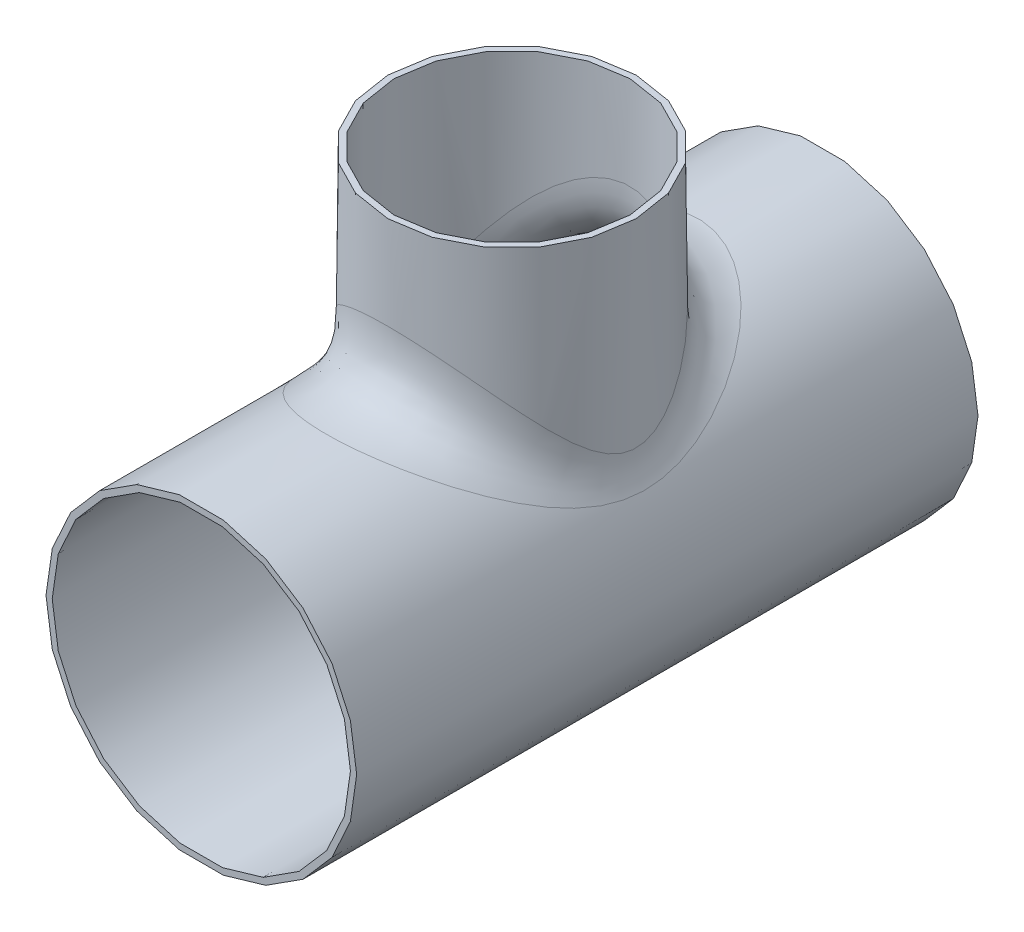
SolidWorks part; units mm, degrees
ref_plane "Vorne" through (0, 0, 0) normal (0, 0, 1) x (1, 0, 0)
ref_plane "Oben" through (0, 0, 0) normal (0, 1, 0) x (1, 0, 0)
ref_plane "Rechts" through (0, 0, 0) normal (1, 0, 0) x (0, 0, -1)
sketch "Skizze1" plane through (0, 0, 0) normal (0, 0, 1) x (1, 0, 0)
  circle A0 centre (0, 0) radius 25
  dimension "D1" = 50
extrude "Linear austragen1" add sketch "Skizze1" along normal mid plane 100
sketch "Skizze2" plane through (0, 0, 0) normal (0, 1, 0) x (1, 0, 0)
  circle A0 centre (0, 0) radius 20
  dimension "D1" = 40
extrude "Linear austragen2" add sketch "Skizze2" along normal blind 50
fillet "Verrundung1" radius 10 1 edges at (2.3429, 24.89, 19.8623)
shell "Wandung1" thickness 1
